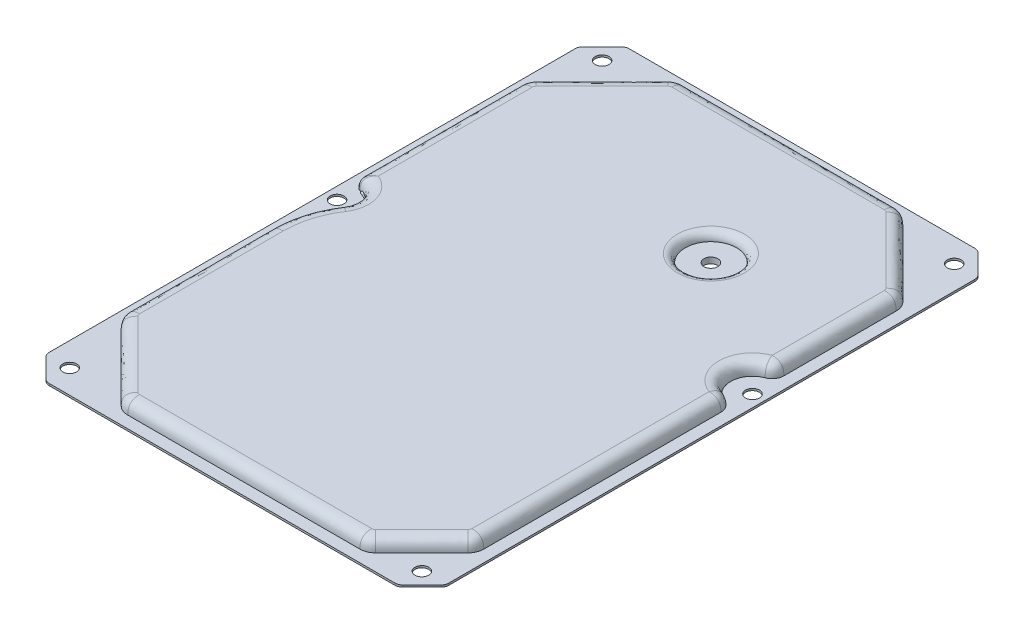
SolidWorks part; units mm, degrees
ref_plane "Front Plane" through (0, 0, 0) normal (0, 0, 1) x (1, 0, 0)
ref_plane "Top Plane" through (0, 0, 0) normal (0, 1, 0) x (1, 0, 0)
ref_plane "Right Plane" through (0, 0, 0) normal (1, 0, 0) x (0, 0, -1)
sketch "Sketch1" plane through (0, 0, 0) normal (0, 1, 0) x (1, 0, 0)
  line L0 (101.2642, -5.4142) -> (96.4358, -0.5858)
  line L5 (7.6784, 0) -> (95.0216, 0)
  line L6 (0.85, -6.8284) -> (0.85, -139.7316)
  line L7 (7.6784, -146.56) -> (95.0216, -146.56)
  line L8 (101.85, -6.8284) -> (101.85, -139.7316)
  line L9 (6.2642, -0.5858) -> (1.4358, -5.4142)
  line L10 (1.4358, -141.1458) -> (6.2642, -145.9742)
  line L11 (101.2642, -141.1458) -> (96.4358, -145.9742)
  arc A0 (7.6784, 0) -> (6.2642, -0.5858) centre (7.6784, -2) ccw
  arc A1 (0.85, -6.8284) -> (1.4358, -5.4142) centre (2.85, -6.8284) cw
  arc A2 (96.4358, -0.5858) -> (95.0216, 0) centre (95.0216, -2) ccw
  arc A3 (101.85, -6.8284) -> (101.2642, -5.4142) centre (99.85, -6.8284) ccw
  arc A4 (101.2642, -141.1458) -> (101.85, -139.7316) centre (99.85, -139.7316) ccw
  arc A5 (95.0216, -146.56) -> (96.4358, -145.9742) centre (95.0216, -144.56) ccw
  arc A6 (6.2642, -145.9742) -> (7.6784, -146.56) centre (7.6784, -144.56) ccw
  arc A7 (1.4358, -141.1458) -> (0.85, -139.7316) centre (2.85, -139.7316) cw
  point P0 (0.85, -140.56)
  point P3 (0.85, -6)
  point P5 (95.85, 0)
  point P6 (101.85, -6)
  point P10 (6.85, 0)
  point P12 (6.85, -146.56)
  point P13 (95.85, -146.56)
  point P15 (101.85, -140.56)
  point P19 (6.85, 0)
  point P22 (0.85, -6)
  point P28 (95.85, 0)
  point P31 (101.85, -6)
  point P34 (101.85, -140.56)
  point P37 (95.85, -146.56)
  point P40 (6.85, -146.56)
  point P43 (0.85, -140.56)
  dimension "D13" = 2
  dimension "D14" = 2
  dimension "D15" = 2
  dimension "D16" = 2
  dimension "D17" = 2
  dimension "D18" = 2
  dimension "D19" = 2
  dimension "D20" = 2
  dimension "D1" = 101.85
  dimension "D2" = 146.56
  dimension "D3" = 6
  dimension "D4" = 6
  dimension "D5" = 6
  dimension "D6" = 6
  dimension "D7" = 101
  dimension "D8" = 146.56
  dimension "D9" = 6
  dimension "D10" = 6
  dimension "D11" = 6
  dimension "D12" = 6
extrude "Boss-Extrude1" add sketch "Sketch1" along normal blind 0.5
sketch "Sketch2" plane through (0, 0.5, 0) normal (0, 1, 0) x (1, 0, 0)
  line L0 (95.0216, 0) -> (7.6784, 0) construction
  line L1 (24.5069, -3) -> (78.1931, -3)
  line L2 (3.85, -23.6569) -> (3.85, -64.0839)
  line L3 (24.5069, -143.56) -> (83.1931, -143.56)
  line L4 (98.85, -23.6569) -> (98.85, -52.047)
  line L5 (101.85, -139.7316) -> (101.85, -6.8284) construction
  line L6 (0.85, -6.8284) -> (0.85, -139.7316) construction
  line L7 (7.6784, -146.56) -> (95.0216, -146.56) construction
  line L8 (5.0216, -20.8284) -> (21.6784, -4.1716)
  line L9 (97.6784, -20.8284) -> (81.0216, -4.1716)
  line L10 (86.0216, -142.3884) -> (97.6784, -130.7316)
  line L11 (21.6784, -142.3884) -> (5.0216, -125.7316)
  line L12 (95.0216, 0) -> (7.6784, 0) construction
  line L13 (98.85, -67.953) -> (98.85, -127.9031)
  line L14 (3.85, -86.5831) -> (3.85, -122.9031)
  line L15 (0.85, -6.8284) -> (0.85, -139.7316) construction
  line L16 (101.85, -139.7316) -> (101.85, -6.8284) construction
  arc A0 (83.1931, -143.56) -> (86.0216, -142.3884) centre (83.1931, -139.56) ccw
  arc A1 (98.85, -23.6569) -> (97.6784, -20.8284) centre (94.85, -23.6569) ccw
  arc A2 (81.0216, -4.1716) -> (78.1931, -3) centre (78.1931, -7) ccw
  arc A3 (24.5069, -3) -> (21.6784, -4.1716) centre (24.5069, -7) ccw
  arc A4 (5.0216, -20.8284) -> (3.85, -23.6569) centre (7.85, -23.6569) ccw
  arc A5 (3.85, -122.9031) -> (5.0216, -125.7316) centre (7.85, -122.9031) ccw
  arc A6 (21.6784, -142.3884) -> (24.5069, -143.56) centre (24.5069, -139.56) ccw
  arc A7 (98.85, -127.9031) -> (97.6784, -130.7316) centre (94.85, -127.9031) cw
  arc A8 (96.9088, -54.8539) -> (96.9088, -65.1461) centre (98.85, -60) ccw
  arc A9 (96.9088, -65.1461) -> (98.85, -67.953) centre (95.85, -67.953) cw
  arc A10 (96.9088, -54.8539) -> (98.85, -52.047) centre (95.85, -52.047) ccw
  arc A11 (8.0167, -72.7639) -> (4.6833, -65.0699) centre (3.85, -70) ccw
  arc A12 (8.0167, -72.7639) -> (3.85, -86.5831) centre (28.85, -86.5831) ccw
  arc A13 (4.6833, -65.0699) -> (3.85, -64.0839) centre (4.85, -64.0839) cw
  point P0 (79.85, -3)
  point P3 (84.85, -143.56)
  point P12 (22.85, -3)
  point P13 (3.85, -22)
  point P16 (98.85, -22)
  point P19 (98.85, -129.56)
  point P20 (22.85, -143.56)
  point P23 (3.85, -124.56)
  point P26 (84.85, -143.56)
  point P29 (98.85, -22)
  point P32 (79.85, -3)
  point P35 (22.85, -3)
  point P38 (3.85, -22)
  point P41 (3.85, -124.56)
  point P44 (22.85, -143.56)
  point P47 (98.85, -129.56)
  point P48 (98.85, -60)
  point P56 (98.85, -65.5)
  point P59 (3.85, -70)
  point P65 (3.85, -75)
  dimension "D13" = 4
  dimension "D14" = 4
  dimension "D16" = 11
  dimension "D17" = 3
  dimension "D19" = 10
  dimension "D20" = 25
  dimension "D21" = 1
  dimension "D1" = 3
  dimension "D2" = 3
  dimension "D3" = 3
  dimension "D4" = 3
  dimension "D5" = 22
  dimension "D6" = 19
  dimension "D7" = 19
  dimension "D8" = 19
  dimension "D9" = 17
  dimension "D10" = 14
  dimension "D11" = 22
  dimension "D12" = 19
  dimension "D15" = 60
  dimension "D18" = 70
extrude "Boss-Extrude2" add sketch "Sketch2" along normal blind 3
sketch "Sketch5" plane through (0, 3.5, 0) normal (0, 1, 0) x (1, 0, 0)
  line L0 (98.85, -52.047) -> (98.85, -23.6569) construction
  line L1 (78.1931, -3) -> (24.5069, -3) construction
  circle A0 centre (65.85, -37.5) radius 6.5
  dimension "D3" = 13
  dimension "D1" = 33
  dimension "D2" = 34.5
extrude "Cut-Extrude1" cut sketch "Sketch5" against normal blind 2
sketch "Sketch6" plane through (0, 1.5, 0) normal (0, 1, 0) x (1, 0, 0)
  line L0 (98.85, -52.047) -> (98.85, -23.6569) construction
  line L1 (78.1931, -3) -> (24.5069, -3) construction
  circle A0 centre (65.85, -37.5) radius 1.75
  dimension "D3" = 3.5
  dimension "D1" = 33
  dimension "D2" = 34.5
extrude "Cut-Extrude2" cut sketch "Sketch6" against normal blind 12
sketch "Sketch7" plane through (0, 0.5, 0) normal (0, 1, 0) x (1, 0, 0)
  line L0 (101.85, -139.7316) -> (101.85, -6.8284) construction
  line L1 (7.6784, -146.56) -> (95.0216, -146.56) construction
  line L2 (95.0216, 0) -> (7.6784, 0) construction
  line L3 (0.85, -6.8284) -> (0.85, -139.7316) construction
  circle A0 centre (95.85, -6) radius 1.75
  circle A1 centre (6.85, -6) radius 1.75
  circle A2 centre (98.85, -60) radius 1.75
  circle A3 centre (95.85, -140.56) radius 1.75
  circle A4 centre (6.85, -140.56) radius 1.75
  circle A5 centre (3.85, -70) radius 1.75
  dimension "D1" = 3.5
  dimension "D4" = 3.5
  dimension "D9" = 3.5
  dimension "D12" = 3.5
  dimension "D15" = 3.5
  dimension "D18" = 3.5
  dimension "D2" = 6
  dimension "D3" = 6
  dimension "D5" = 6
  dimension "D6" = 6
  dimension "D7" = 3
  dimension "D8" = 60
  dimension "D10" = 6
  dimension "D11" = 6
  dimension "D13" = 6
  dimension "D14" = 6
  dimension "D16" = 3
  dimension "D17" = 70
extrude "Cut-Extrude3" cut sketch "Sketch7" against normal blind 10
fillet "Fillet1" radius 3 23 edges at (4.9143, 3.5, 79.3662) (8.4379, 3.5, 68.0123) (3.85, 3.5, 43.8704) (4.1545, 3.5, 22.1261) (13.35, 3.5, 12.5) (22.9761, 3.5, 3.3045) (51.35, 3.5, 3) (79.7239, 3.5, 3.3045) (89.35, 3.5, 12.5) (98.5455, 3.5, 22.1261) (98.85, 3.5, 37.8519) (98.3174, 3.5, 53.7534) (93.35, 3.5, 60) (98.3174, 3.5, 66.2466) (98.85, 3.5, 97.9281) (98.5455, 3.5, 129.4339) (91.85, 3.5, 136.56) (84.7239, 3.5, 143.2555) (53.85, 3.5, 143.56) (22.9761, 3.5, 143.2555) (13.35, 3.5, 134.06) (4.1545, 3.5, 124.4339) (3.85, 3.5, 104.7431)
sketch "Sketch9" plane through (0, 0, 0) normal (0, -1, 0) x (1, 0, 0)
  line L10 (78.0216, 4) -> (24.6784, 4)
  line L20 (23.2642, 4.5858) -> (5.4358, 22.4142)
  line L21 (97.85, 23.8284) -> (97.85, 50.8348)
  line L22 (97.85, 69.1652) -> (97.85, 128.7316)
  line L23 (5.4358, 124.1458) -> (23.2642, 141.9742)
  line L24 (0.85, 6.8284) -> (0.85, 139.7316) construction
  line L25 (85.4358, 141.9742) -> (97.2642, 130.1458)
  line L26 (79.4358, 4.5858) -> (97.2642, 22.4142)
  line L27 (4.85, 122.7316) -> (4.85, 86.5831)
  line L29 (24.6784, 142.56) -> (84.0216, 142.56)
  line L30 (7.6784, 146.56) -> (95.0216, 146.56) construction
  line L31 (95.0216, 0) -> (7.6784, 0) construction
  line L32 (101.85, 139.7316) -> (101.85, 6.8284) construction
  line L33 (4.85, 63.2918) -> (4.85, 23.8284)
  line L34 (72.85, 27.7532) -> (81.85, 18.2906)
  line L35 (73.85, 46.4443) -> (84.85, 53.7481)
  arc A32 (6.2786, 65.2084) -> (9.0167, 72.7639) centre (4.85, 70) ccw
  arc A33 (6.2786, 65.2084) -> (4.85, 63.2918) centre (6.85, 63.2918) ccw
  arc A34 (5.4358, 22.4142) -> (4.85, 23.8284) centre (6.85, 23.8284) cw
  arc A35 (95.45, 65.4991) -> (95.45, 54.5009) centre (97.85, 60) ccw
  arc A36 (24.6784, 4) -> (23.2642, 4.5858) centre (24.6784, 6) cw
  arc A37 (78.0216, 4) -> (79.4358, 4.5858) centre (78.0216, 6) ccw
  arc A38 (97.85, 23.8284) -> (97.2642, 22.4142) centre (95.85, 23.8284) cw
  arc A39 (97.85, 128.7316) -> (97.2642, 130.1458) centre (95.85, 128.7316) ccw
  arc A40 (85.4358, 141.9742) -> (84.0216, 142.56) centre (84.0216, 140.56) ccw
  arc A41 (23.2642, 141.9742) -> (24.6784, 142.56) centre (24.6784, 140.56) cw
  arc A42 (4.85, 122.7316) -> (5.4358, 124.1458) centre (6.85, 122.7316) cw
  arc A43 (9.0167, 72.7639) -> (4.85, 86.5831) centre (29.85, 86.5831) cw
  arc A44 (95.45, 54.5009) -> (97.85, 50.8348) centre (93.85, 50.8348) cw
  arc A45 (95.45, 65.4991) -> (97.85, 69.1652) centre (93.85, 69.1652) ccw
  circle A46 centre (65.85, 37.5) radius 7
  arc A47 (72.85, 27.7532) -> (73.85, 46.4443) centre (65.85, 37.5) ccw
  arc A48 (81.85, 18.2906) -> (84.85, 53.7481) centre (65.85, 37.5) ccw
  point P4 (4.85, 43.5601)
  point P10 (4.85, 65)
  point P13 (4.85, 23)
  point P19 (23.85, 4)
  point P26 (78.85, 4)
  point P32 (97.85, 23)
  point P39 (97.85, 129.56)
  point P42 (84.85, 142.56)
  point P46 (23.85, 142.56)
  point P50 (50.5, 72.5)
  point P51 (4.85, 123.56)
  point P56 (97.85, 54)
  point P62 (72.85, 27.7532)
  point P63 (81.85, 18.2906)
  point P66 (73.85, 46.4443)
  point P67 (84.85, 53.7481)
  dimension "D1" = 17
  dimension "D2" = 4
  dimension "D3" = 4
  dimension "D4" = 4
  dimension "D5" = 4
  dimension "D7" = 23
  dimension "D16" = 12
  dimension "D18" = 10
  dimension "D21" = 2
  dimension "D22" = 25
  dimension "D23" = 4
  dimension "D24" = 14
  dimension "D25" = 24
  dimension "D26" = 50
  dimension "D28" = 20
  dimension "D6" = 17
  dimension "D8" = 23
  dimension "D9" = 4
  dimension "D10" = 23
  dimension "D11" = 23
  dimension "D12" = 23
  dimension "D13" = 23
  dimension "D14" = 4
  dimension "D15" = 60
  dimension "D17" = 70
  dimension "D19" = 54
  dimension "D20" = 65
  dimension "D27" = 29
  dimension "D29" = 28
  dimension "D30" = 17
extrude "Cut-Extrude6" cut sketch "Sketch9" against normal blind 2
fillet "Fillet2" radius 2 24 edges at (4.85, 0, 104.6573) (5.9143, 0, 79.3662) (5.0022, 0, 123.4969) (9.5508, 0, 68.2964) (14.35, 0, 133.06) (5.2464, 0, 64.487) (23.9131, 0, 142.4078) (4.85, 0, 43.5601) (54.35, 0, 142.56) (5.0022, 0, 23.0631) (84.7869, 0, 142.4078) (14.35, 0, 13.5) (91.35, 0, 136.06) (23.9131, 0, 4.1522) (97.6978, 0, 129.4969) (51.35, 0, 4) (97.85, 0, 98.9484) (78.7869, 0, 4.1522) (97.1966, 0, 66.9743) (88.35, 0, 13.5) (91.85, 0, 60) (97.6978, 0, 23.0631) (97.1966, 0, 53.0257) (97.85, 0, 37.3316)
fillet "Fillet3" radius 2 4 edges at (79.35, 0, 50.0962) (77.8329, 0, 36.8589) (77.35, 0, 23.0219) (90.761, 0, 35.3923)
fillet "Fillet4" radius 2 1 edges at (65.85, 0, 30.5)
fillet "Fillet5" radius 2 1 edges at (65.85, 3.5, 44)
